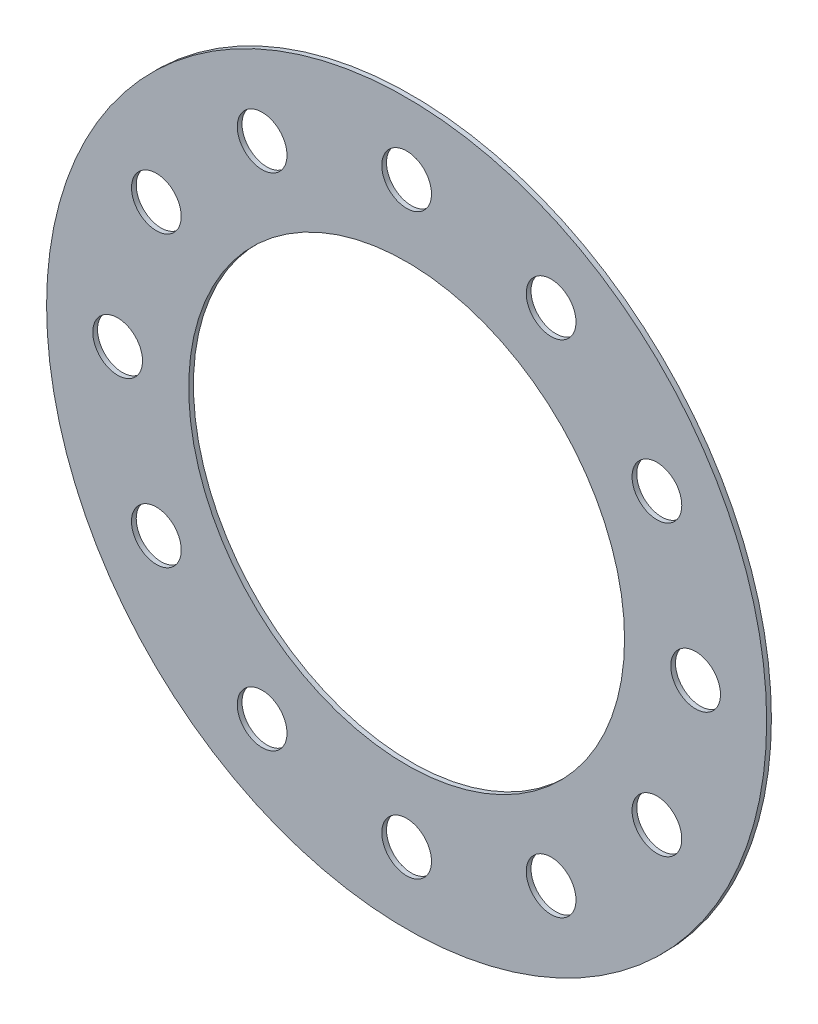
SolidWorks part; units mm, degrees
ref_plane "Alzado" through (0, 0, 0) normal (0, 0, 1) x (1, 0, 0)
ref_plane "Planta" through (0, 0, 0) normal (0, 1, 0) x (1, 0, 0)
ref_plane "Vista lateral" through (0, 0, 0) normal (1, 0, 0) x (0, 0, -1)
sketch "Croquis1" plane through (0, 0, 0) normal (0, 0, 1) x (1, 0, 0)
  circle A0 centre (0, 0) radius 46
  circle A1 centre (0, 0) radius 76
  dimension "D1" = 92
  dimension "D2" = 152
extrude "Saliente-Extruir1" add sketch "Croquis1" along normal blind 1
sketch "Croquis2" plane through (0, 0, 0) normal (0, 0, -1) x (-1, 0, 0)
  line L0 (0, 0) -> (0, 61) construction
  circle A0 centre (0, 61) radius 5.25
  dimension "D2" = 10.5
  dimension "D1" = 61
extrude "Cortar-Extruir1" cut sketch "Croquis2" against normal blind 1
pattern_circular "MatrizC1" count 12 over 360 about axis through (0, 0, 0) along (0, 0, 1) of "Cortar-Extruir1"
